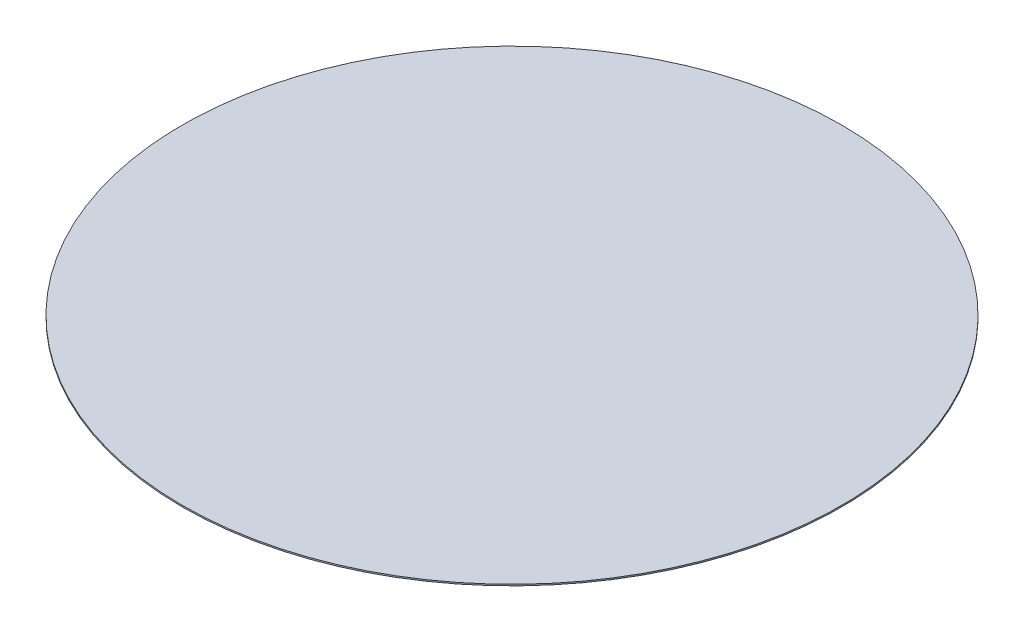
SolidWorks part; units mm, degrees
ref_plane "Front Plane" through (0, 0, 0) normal (0, 0, 1) x (1, 0, 0)
ref_plane "Top Plane" through (0, 0, 0) normal (0, 1, 0) x (1, 0, 0)
ref_plane "Right Plane" through (0, 0, 0) normal (1, 0, 0) x (0, 0, -1)
sketch "Sketch1" plane through (0, 0, 0) normal (0, 1, 0) x (1, 0, 0)
  circle A0 centre (0, 0) radius 23.5
  dimension "D1" = 47
extrude "Boss-Extrude1" add sketch "Sketch1" along normal blind 0.1
